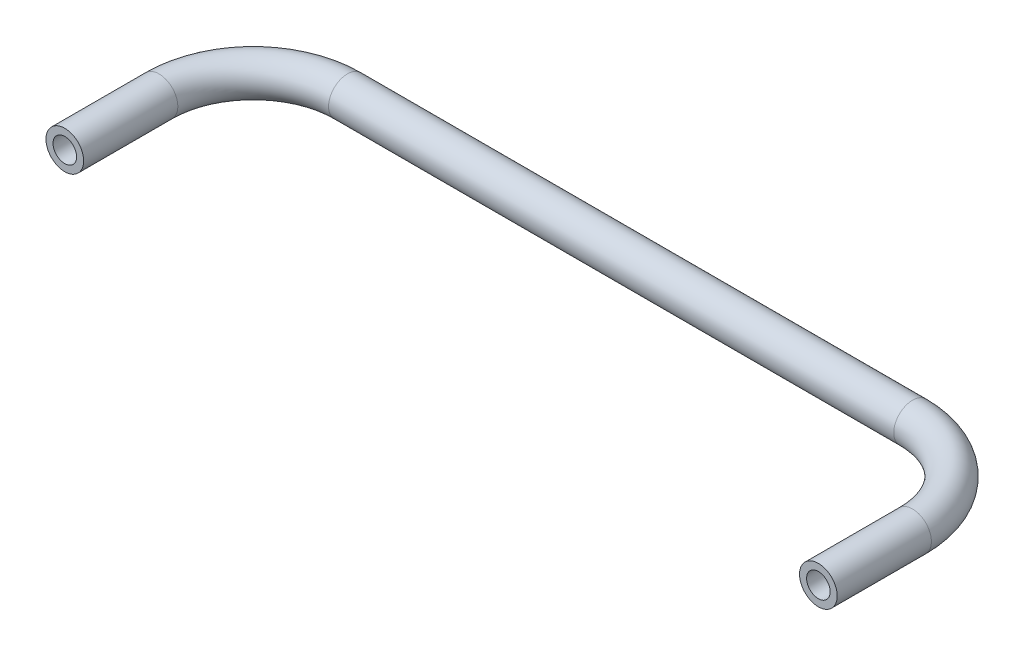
SolidWorks part; units mm, degrees
ref_plane "Front Plane" through (0, 0, 0) normal (0, 0, 1) x (1, 0, 0)
ref_plane "Top Plane" through (0, 0, 0) normal (0, 1, 0) x (1, 0, 0)
ref_plane "Right Plane" through (0, 0, 0) normal (1, 0, 0) x (0, 0, -1)
sketch "Sketch1" plane through (0, 0, 0) normal (0, 1, 0) x (1, 0, 0)
  line L0 (-57.15, 0) -> (57.15, 0)
  line L1 (76.2, -19.05) -> (76.2, -38.1)
  line L2 (-76.2, -19.05) -> (-76.2, -38.1)
  arc A0 (-57.15, 0) -> (-76.2, -19.05) centre (-57.15, -19.05) ccw
  arc A1 (57.15, 0) -> (76.2, -19.05) centre (57.15, -19.05) cw
  point P8 (-76.2, 0)
  point P11 (76.2, 0)
  dimension "D3" = 19.05
  dimension "D4" = 19.05
  dimension "D1" = 152.4
  dimension "D2" = 38.1
ref_plane "Plane1" through (-76.2, 0, 38.1) normal (0, 0, 1) x (1, 0, 0)
sketch "Sketch2" plane through (-76.2, 0, 38.1) normal (0, 0, 1) x (1, 0, 0)
  circle A0 centre (0, 0) radius 3.81
  dimension "D1" = 7.62
sweep "Sweep1" add profiles "Sketch2" path "Sketch1"
hole_wizard "3/16 (0.1875) Diameter Hole1" positions "Sketch4" profile "Sketch3" hole size "3/16" standard "Ansi Inch"
sketch "Sketch4" plane through (0, 0, 38.1) normal (0, 0, 1) x (1, 0, 0)
  point P0 (-76.2, 0)
  point P1 (76.2, 0)
sketch "Sketch3" plane through (-76.2, 0, 38.1) normal (1, 0, 0) x (0, -1, 0)
  line L0 (0, 0) -> (0, 20.4808)
  line L1 (0, 20.4808) -> (2.3812, 19.05)
  line L2 (2.3812, 19.05) -> (2.3812, 0)
  line L5 (2.3812, 0) -> (0, 0)
  line L10 (0, 20.4808) -> (-2.3813, 19.05) construction
  line L11 (0, -6.35) -> (0, 107.95) construction
  dimension "Hole Dia." = 4.7625
  dimension "Hole Depth" = 19.05
  dimension "Drill Angle" = 118
